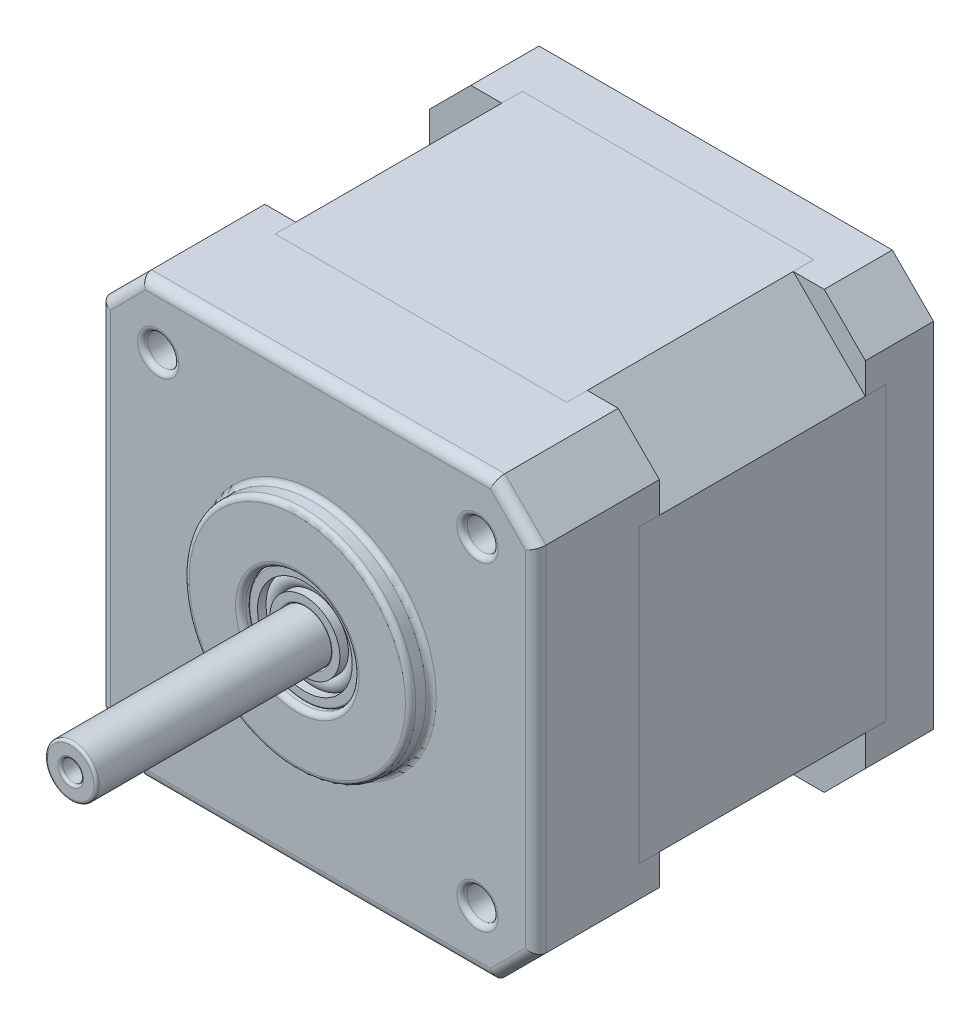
SolidWorks part; units mm, degrees
ref_plane "Front Plane" through (0, 0, 0) normal (0, 0, 1) x (1, 0, 0)
ref_plane "Top Plane" through (0, 0, 0) normal (0, 1, 0) x (1, 0, 0)
ref_plane "Right Plane" through (0, 0, 0) normal (1, 0, 0) x (0, 0, -1)
imported_body "Base-1-solid1"
imported_body "Cuerpo-1-solid1"
imported_body "Tapa-1-solid1"
imported_body "pan cross head_am-1-solid1"
imported_body "pan cross head_am-2-solid1"
imported_body "pan cross head_am-3-solid1"
imported_body "pan cross head_am-4-solid1"
imported_body "Eje-1-solid1"
imported_body "instrument ball bearing_68_am-2-solid1"
imported_body "instrument ball bearing_68_am-4-solid1"
sketch "Sketch1" plane through (0, 0, 0) normal (0, 0, -1) x (-1, 0, 0)
  line L0 (31.5455, -12.5328) -> (27.5455, -16.5328) construction
  line L1 (27.5455, -16.5328) -> (-6.7545, -16.5328) construction
  line L2 (-6.7545, -16.5328) -> (-10.7545, -12.5328) construction
  line L3 (-10.7545, -12.5328) -> (-10.7545, 21.7672) construction
  line L4 (-10.7545, 21.7672) -> (-6.7545, 25.7672) construction
  line L5 (-6.7545, 25.7672) -> (27.5455, 25.7672) construction
  line L6 (27.5455, 25.7672) -> (31.5455, 21.7672) construction
  line L7 (31.5455, 21.7672) -> (31.5455, -12.5328) construction
  line L8 (31.5455, -12.5328) -> (27.5455, -16.5328)
  line L9 (27.5455, -16.5328) -> (-6.7545, -16.5328)
  line L10 (-6.7545, -16.5328) -> (-10.7545, -12.5328)
  line L11 (-10.7545, -12.5328) -> (-10.7545, 21.7672)
  line L12 (-10.7545, 21.7672) -> (-6.7545, 25.7672)
  line L13 (-6.7545, 25.7672) -> (27.5455, 25.7672)
  line L14 (27.5455, 25.7672) -> (31.5455, 21.7672)
  line L15 (31.5455, 21.7672) -> (31.5455, -12.5328)
extrude "Cut-Extrude1" cut sketch "Sketch1" against normal blind 5.3848
